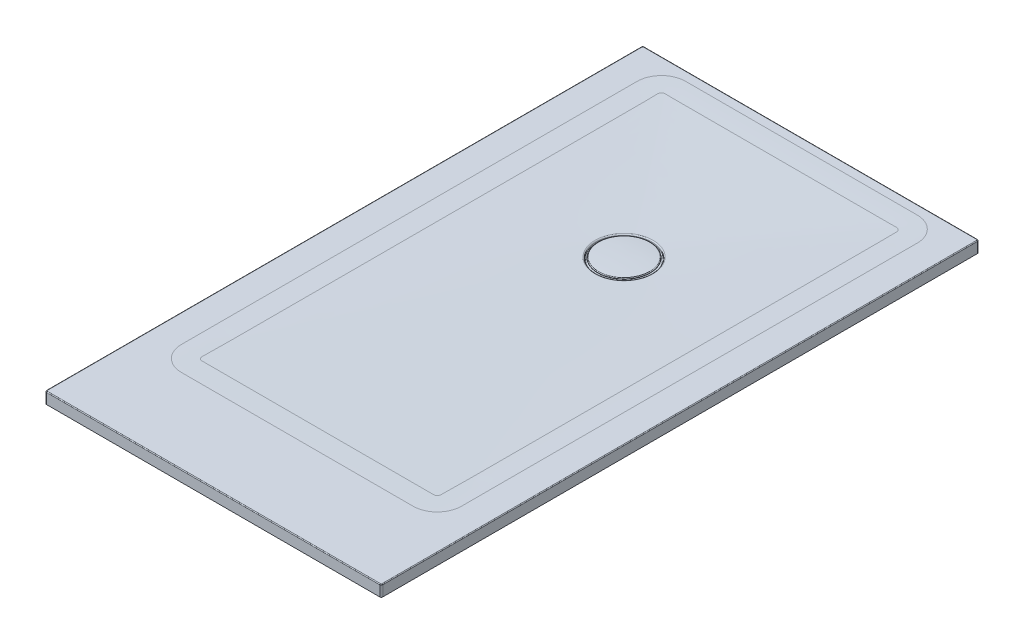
SolidWorks part; units mm, degrees
ref_plane "Płaszczyzna przednia" through (0, 0, 0) normal (0, 0, 1) x (1, 0, 0)
ref_plane "Płaszczyzna górna" through (0, 0, 0) normal (0, 1, 0) x (1, 0, 0)
ref_plane "Płaszczyzna prawa" through (0, 0, 0) normal (1, 0, 0) x (0, 0, -1)
sketch "Szkic2" plane through (0, 0, 0) normal (0, 1, 0) x (1, 0, 0)
  line L0 (0, 800) -> (0, 300) construction
  line L1 (-450, -800) -> (450, -800)
  line L2 (-450, -800) -> (-450, 800)
  line L3 (-450, 800) -> (450, 800)
  line L4 (450, -800) -> (450, 800)
  line L5 (-450, -800) -> (450, 800) construction
  line L6 (-450, 800) -> (450, -800) construction
  line L7 (-360, 760) -> (360, 760)
  line L8 (-360, 760) -> (-360, -560)
  line L9 (-360, -560) -> (360, -560)
  line L10 (360, 760) -> (360, -560)
  line L11 (-400, 800) -> (-400, -600) construction
  line L12 (-400, -600) -> (400, -600) construction
  line L13 (400, -600) -> (400, 800) construction
  circle A0 centre (0, 300) radius 75
  point P0 (0, 0)
  point P11 (0, 760)
  point P16 (0, -600)
  dimension "D9" = 150
  dimension "D1" = 900
  dimension "D2" = 1600
  dimension "D3" = 40
  dimension "D4" = 90
  dimension "D5" = 40
  dimension "D6" = 50
  dimension "D7" = 1400
  dimension "D8" = 500
sketch "Szkic3" plane through (0, 0, 0) normal (0, 1, 0) x (1, 0, 0)
  line L0 (-450, -800) -> (-450, 800) construction
  line L1 (-450, -800) -> (450, -800) construction
  line L2 (450, -800) -> (450, 800) construction
  line L3 (-450, 800) -> (450, 800) construction
  line L4 (-360, 760) -> (-360, -560) construction
  line L5 (-360, 760) -> (360, 760) construction
  line L6 (360, 760) -> (360, -560) construction
  line L7 (-360, -560) -> (360, -560) construction
  line L8 (-450, -800) -> (-450, 800)
  line L9 (-450, -800) -> (450, -800)
  line L10 (450, -800) -> (450, 800)
  line L11 (-450, 800) -> (450, 800)
  line L12 (-360, 710) -> (-360, -510)
  line L13 (-310, 760) -> (310, 760)
  line L14 (360, 710) -> (360, -510)
  line L15 (-310, -560) -> (310, -560)
  arc A0 (360, 710) -> (310, 760) centre (310, 710) ccw
  arc A1 (-310, 760) -> (-360, 710) centre (-310, 710) ccw
  arc A2 (310, -560) -> (360, -510) centre (310, -510) ccw
  arc A3 (-310, -560) -> (-360, -510) centre (-310, -510) cw
  dimension "D1" = 50
surface "Powierzchnia-Płaszczyzna1" sketch "Szkic3"
sketch "Szkic4" plane through (0, 0, 0) normal (0, 1, 0) x (1, 0, 0)
  line L0 (-360, 760) -> (-360, -560) construction
  line L1 (-360, -560) -> (360, -560) construction
  line L2 (360, 760) -> (360, -560) construction
  line L3 (-360, 760) -> (360, 760) construction
  line L4 (-360, 760) -> (-360, -560)
  line L5 (-360, -560) -> (360, -560)
  line L6 (360, 760) -> (360, -560)
  line L7 (-360, 760) -> (360, 760)
ref_plane "korek" through (0, -15, 0) normal (0, 1, 0) x (-1, 0, 0)
sketch "Szkic5" plane through (0, -15, 0) normal (0, 1, 0) x (-1, 0, 0)
  circle A0 centre (0, -300) radius 75 construction
  circle A1 centre (0, -300) radius 75
surface "Powierzchnia-Wyciągnięcie po profilach2"
surface "Powierzchnia-Połącz1"
sketch "Szkic7" plane through (0, 0, 0) normal (0, 1, 0) x (1, 0, 0)
  line L27 (310, 720) -> (-310, 720)
  line L28 (-320, 710) -> (-320, -510)
  line L29 (-310, -520) -> (310, -520)
  line L30 (320, -510) -> (320, 710)
  line L31 (310, 720) -> (-310, 720)
  line L32 (-320, 710) -> (-320, -510)
  line L33 (-310, -520) -> (310, -520)
  line L34 (320, -510) -> (320, 710)
  line L35 (310, 775) -> (-310, 775)
  line L36 (-375, 710) -> (-375, -510)
  line L37 (-310, -575) -> (310, -575)
  line L38 (375, -510) -> (375, 710)
  line L39 (310, 775) -> (-310, 775)
  line L40 (-375, 710) -> (-375, -510)
  line L41 (-310, -575) -> (310, -575)
  line L42 (375, -510) -> (375, 710)
  arc A0 (320, -510) -> (310, -520) centre (310, -510) cw
  arc A1 (-320, -510) -> (-310, -520) centre (-310, -510) ccw
  arc A2 (320, 710) -> (310, 720) centre (310, 710) ccw
  arc A3 (-320, 710) -> (-310, 720) centre (-310, 710) cw
  spline S23 degree 3 poles (-641.399, 434.849) (129.105, 603.8543) (327.0889, 675.3764) (319.7448, 712.2674) (319.666, 712.5841) (319.4757, 713.212) (319.3642, 713.5241) (318.9881, 714.4319) (318.6815, 715.0061) (318.1377, 715.8209) (317.9418, 716.0857) (317.524, 716.5952) (317.3042, 716.8377) (316.6129, 717.5296) (316.1099, 717.9435) (315.291, 718.492) (315.0071, 718.6623) (314.4303, 718.9711) (314.1358, 719.1105) (313.5347, 719.3602) (313.228, 719.4702) (312.6027, 719.6611) (312.2823, 719.7411) (241.0094, 734.0944) (80.9725, -51.7096) (205.0888, 1714.4742) knots -7.033481 -7.033481 -7.033481 -7.033481 0.125 0.125 0.1875 0.1875 0.25 0.25 0.375 0.375 0.4375 0.4375 0.5 0.5 0.625 0.625 0.6875 0.6875 0.75 0.75 0.8125 0.8125 0.875 0.875 14.60722 14.60722 14.60722 14.60722 only from (320, 710) to (310, 720)
  spline S24 degree 3 poles (-440.428, 1711.4534) (-279.1841, 688.562) (-297.6269, 720.6455) (-310.6569, 719.9802) (-310.8198, 719.9671) (-311.3068, 719.9193) (-311.629, 719.8723) (-312.2675, 719.7445) (-312.5843, 719.6661) (-313.2122, 719.4757) (-313.5243, 719.3642) (-314.432, 718.988) (-315.0062, 718.6813) (-316.0927, 717.9564) (-316.6073, 717.5346) (-317.5296, 716.6128) (-317.9435, 716.1098) (-318.492, 715.291) (-318.6623, 715.0071) (-318.9711, 714.4303) (-319.1105, 714.1358) (-319.3602, 713.5347) (-319.4702, 713.228) (-319.661, 712.6027) (-319.7414, 712.2824) (-329.2071, 664.9991) (3.328, 579.9665) (648.2833, 460.148) knots -2.425653 -2.425653 -2.425653 -2.425653 0.03125 0.03125 0.0625 0.0625 0.125 0.125 0.1875 0.1875 0.25 0.25 0.375 0.375 0.5 0.5 0.625 0.625 0.6875 0.6875 0.75 0.75 0.8125 0.8125 0.875 0.875 9.962622 9.962622 9.962622 9.962622 only from (-310, 720) to (-320, 710)
  spline S25 degree 3 poles (641.3989, -234.849) (-129.105, -403.8543) (-327.0889, -475.3764) (-319.7448, -512.2674) (-319.666, -512.5841) (-319.4757, -513.212) (-319.3642, -513.5241) (-318.9881, -514.4319) (-318.6815, -515.0061) (-318.1377, -515.8209) (-317.9418, -516.0857) (-317.524, -516.5952) (-317.3042, -516.8377) (-316.6129, -517.5296) (-316.1099, -517.9435) (-315.291, -518.492) (-315.0071, -518.6623) (-314.4303, -518.9711) (-314.1358, -519.1105) (-313.5347, -519.3602) (-313.228, -519.4702) (-312.6027, -519.6611) (-312.2823, -519.7411) (-241.0094, -534.0944) (-80.9725, 251.7096) (-205.0888, -1514.4742) knots -7.033481 -7.033481 -7.033481 -7.033481 0.125 0.125 0.1875 0.1875 0.25 0.25 0.375 0.375 0.4375 0.4375 0.5 0.5 0.625 0.625 0.6875 0.6875 0.75 0.75 0.8125 0.8125 0.875 0.875 14.60722 14.60722 14.60722 14.60722 only from (-320, -510) to (-310, -520)
  spline S26 degree 3 poles (440.428, -1511.4535) (279.1841, -488.562) (297.6269, -520.6455) (310.6569, -519.9802) (310.8198, -519.9671) (311.3068, -519.9193) (311.629, -519.8723) (312.2675, -519.7445) (312.5843, -519.6661) (313.2122, -519.4757) (313.5243, -519.3642) (314.432, -518.988) (315.0062, -518.6813) (316.0927, -517.9564) (316.6073, -517.5346) (317.5296, -516.6128) (317.9435, -516.1098) (318.492, -515.291) (318.6623, -515.0071) (318.9711, -514.4303) (319.1105, -514.1358) (319.3602, -513.5347) (319.4702, -513.228) (319.661, -512.6027) (319.7414, -512.2824) (329.2071, -464.9991) (-3.328, -379.9665) (-648.2833, -260.148) knots -2.425653 -2.425653 -2.425653 -2.425653 0.03125 0.03125 0.0625 0.0625 0.125 0.125 0.1875 0.1875 0.25 0.25 0.375 0.375 0.5 0.5 0.625 0.625 0.6875 0.6875 0.75 0.75 0.8125 0.8125 0.875 0.875 9.962622 9.962622 9.962622 9.962622 only from (310, -520) to (320, -510)
  spline S31 degree 3 poles (-2470.176, -202.3533) (-59.2357, 353.0092) (388.7143, 574.0384) (374.4776, 718.4945) (374.1669, 720.5875) (373.3421, 724.7387) (372.8284, 726.7971) (371.9014, 729.8581) (371.5659, 730.8756) (370.8441, 732.8942) (370.4597, 733.8905) (368.4228, 738.808) (366.4286, 742.5399) (363.4837, 746.9542) (362.872, 747.8245) (361.6022, 749.5393) (360.9423, 750.386) (358.9054, 752.8701) (357.4764, 754.4464) (352.9829, 758.9432) (349.7137, 761.6339) (345.2776, 764.6043) (344.3701, 765.1801) (342.5356, 766.2813) (341.6081, 766.8072) (338.796, 768.3122) (336.8815, 769.2187) (332.9741, 770.8414) (330.9812, 771.5572) (327.9325, 772.4866) (326.9062, 772.7721) (324.8335, 773.2937) (323.7851, 773.5302) (320.6362, 774.1601) (318.5251, 774.4735) (315.3412, 774.7883) (314.2772, 774.8685) (171.271, 781.9701) (-24.6038, 303.6351) (215.7481, 3751.0408) knots -4.153002 -4.153002 -4.153002 -4.153002 0.0625 0.0625 0.125 0.125 0.1875 0.1875 0.21875 0.21875 0.25 0.25 0.375 0.375 0.40625 0.40625 0.4375 0.4375 0.5 0.5 0.625 0.625 0.65625 0.65625 0.6875 0.6875 0.75 0.75 0.8125 0.8125 0.84375 0.84375 0.875 0.875 0.9375 0.9375 0.96875 0.96875 5.125575 5.125575 5.125575 5.125575 only from (375, 710) to (310, 775)
  spline S32 degree 3 poles (-366.4795, 3748.8604) (78.4358, 250.2272) (-163.3454, 782.3527) (-314.2695, 774.8689) (-315.3288, 774.7893) (-318.4945, 774.4772) (-320.5876, 774.1673) (-324.7388, 773.3418) (-326.7972, 772.8285) (-329.8582, 771.9015) (-330.8757, 771.5658) (-332.8943, 770.8441) (-333.8906, 770.4597) (-338.8081, 768.4227) (-342.54, 766.4285) (-346.9543, 763.4837) (-347.8245, 762.8719) (-349.5393, 761.6021) (-350.386, 760.9423) (-352.8701, 758.9054) (-354.4464, 757.4764) (-358.9432, 752.9828) (-361.6338, 749.7137) (-364.6043, 745.2777) (-365.18, 744.3702) (-366.2812, 742.5356) (-366.8071, 741.6082) (-368.3122, 738.7961) (-369.2187, 736.8815) (-370.8413, 732.9742) (-371.5572, 730.9813) (-372.4865, 727.9325) (-372.772, 726.9063) (-373.2938, 724.8337) (-373.5303, 723.7852) (-412.7967, 527.3214) (454.4469, 231.2431) (2469.5439, -192.3292) knots -4.370349 -4.370349 -4.370349 -4.370349 0.03125 0.03125 0.0625 0.0625 0.125 0.125 0.1875 0.1875 0.21875 0.21875 0.25 0.25 0.375 0.375 0.40625 0.40625 0.4375 0.4375 0.5 0.5 0.625 0.625 0.65625 0.65625 0.6875 0.6875 0.75 0.75 0.8125 0.8125 0.84375 0.84375 0.875 0.875 6.692797 6.692797 6.692797 6.692797 only from (-310, 775) to (-375, 710)
  spline S33 degree 3 poles (2470.1761, 402.3534) (59.2357, -153.0092) (-388.7143, -374.0384) (-374.4776, -518.4945) (-374.1669, -520.5875) (-373.3421, -524.7387) (-372.8284, -526.7971) (-371.9014, -529.8581) (-371.5659, -530.8756) (-370.8441, -532.8942) (-370.4597, -533.8905) (-368.4228, -538.808) (-366.4286, -542.5399) (-363.4837, -546.9542) (-362.872, -547.8245) (-361.6022, -549.5393) (-360.9423, -550.386) (-358.9054, -552.8701) (-357.4764, -554.4464) (-352.9829, -558.9432) (-349.7137, -561.6339) (-345.2776, -564.6043) (-344.3701, -565.1801) (-342.5356, -566.2813) (-341.6081, -566.8072) (-338.796, -568.3122) (-336.8815, -569.2187) (-332.9741, -570.8414) (-330.9812, -571.5572) (-327.9325, -572.4866) (-326.9062, -572.7721) (-324.8335, -573.2937) (-323.7851, -573.5302) (-320.6362, -574.1601) (-318.5251, -574.4735) (-315.3412, -574.7883) (-314.2772, -574.8685) (-171.271, -581.9701) (24.6038, -103.6351) (-215.7481, -3551.0408) knots -4.153002 -4.153002 -4.153002 -4.153002 0.0625 0.0625 0.125 0.125 0.1875 0.1875 0.21875 0.21875 0.25 0.25 0.375 0.375 0.40625 0.40625 0.4375 0.4375 0.5 0.5 0.625 0.625 0.65625 0.65625 0.6875 0.6875 0.75 0.75 0.8125 0.8125 0.84375 0.84375 0.875 0.875 0.9375 0.9375 0.96875 0.96875 5.125575 5.125575 5.125575 5.125575 only from (-375, -510) to (-310, -575)
  spline S34 degree 3 poles (366.4794, -3548.8599) (-78.4358, -50.2272) (163.3454, -582.3527) (314.2695, -574.8689) (315.3288, -574.7893) (318.4945, -574.4772) (320.5876, -574.1673) (324.7388, -573.3418) (326.7972, -572.8285) (329.8582, -571.9015) (330.8757, -571.5658) (332.8943, -570.8441) (333.8906, -570.4597) (338.8081, -568.4227) (342.54, -566.4285) (346.9543, -563.4837) (347.8245, -562.8719) (349.5393, -561.6021) (350.386, -560.9423) (352.8701, -558.9054) (354.4464, -557.4764) (358.9432, -552.9828) (361.6338, -549.7137) (364.6043, -545.2777) (365.18, -544.3702) (366.2812, -542.5356) (366.8071, -541.6082) (368.3122, -538.7961) (369.2187, -536.8815) (370.8413, -532.9742) (371.5572, -530.9813) (372.4865, -527.9325) (372.772, -526.9063) (373.2938, -524.8337) (373.5303, -523.7852) (412.7967, -327.3214) (-454.4469, -31.2431) (-2469.5439, 392.3292) knots -4.370349 -4.370349 -4.370349 -4.370349 0.03125 0.03125 0.0625 0.0625 0.125 0.125 0.1875 0.1875 0.21875 0.21875 0.25 0.25 0.375 0.375 0.40625 0.40625 0.4375 0.4375 0.5 0.5 0.625 0.625 0.65625 0.65625 0.6875 0.6875 0.75 0.75 0.8125 0.8125 0.84375 0.84375 0.875 0.875 6.692797 6.692797 6.692797 6.692797 only from (310, -575) to (375, -510)
  spline S35 degree 3 poles (375, 710) (375, 712.1459) (374.8936, 714.2736) (374.4776, 718.4945) (374.1669, 720.5875) (373.3421, 724.7387) (372.8284, 726.7971) (371.9014, 729.8581) (371.5659, 730.8756) (370.8441, 732.8942) (370.4597, 733.8905) (368.4228, 738.808) (366.4286, 742.5399) (363.4837, 746.9542) (362.872, 747.8245) (361.6022, 749.5393) (360.9423, 750.386) (358.9054, 752.8701) (357.4764, 754.4464) (352.9829, 758.9432) (349.7137, 761.6339) (345.2776, 764.6043) (344.3701, 765.1801) (342.5356, 766.2813) (341.6081, 766.8072) (338.796, 768.3122) (336.8815, 769.2187) (332.9741, 770.8414) (330.9812, 771.5572) (327.9325, 772.4866) (326.9062, 772.7721) (324.8335, 773.2937) (323.7851, 773.5302) (320.6362, 774.1601) (318.5251, 774.4735) (315.3412, 774.7883) (314.2772, 774.8685) (312.1431, 774.9744) (311.073, 775) (310, 775) knots 0 0 0 0 0.0625 0.0625 0.125 0.125 0.1875 0.1875 0.21875 0.21875 0.25 0.25 0.375 0.375 0.40625 0.40625 0.4375 0.4375 0.5 0.5 0.625 0.625 0.65625 0.65625 0.6875 0.6875 0.75 0.75 0.8125 0.8125 0.84375 0.84375 0.875 0.875 0.9375 0.9375 0.96875 0.96875 1 1 1 1
  spline S36 degree 3 poles (-310, 775) (-311.0729, 775) (-312.1415, 774.9744) (-314.2695, 774.8689) (-315.3288, 774.7893) (-318.4945, 774.4772) (-320.5876, 774.1673) (-324.7388, 773.3418) (-326.7972, 772.8285) (-329.8582, 771.9015) (-330.8757, 771.5658) (-332.8943, 770.8441) (-333.8906, 770.4597) (-338.8081, 768.4227) (-342.54, 766.4285) (-346.9543, 763.4837) (-347.8245, 762.8719) (-349.5393, 761.6021) (-350.386, 760.9423) (-352.8701, 758.9054) (-354.4464, 757.4764) (-358.9432, 752.9828) (-361.6338, 749.7137) (-364.6043, 745.2777) (-365.18, 744.3702) (-366.2812, 742.5356) (-366.8071, 741.6082) (-368.3122, 738.7961) (-369.2187, 736.8815) (-370.8413, 732.9742) (-371.5572, 730.9813) (-372.4865, 727.9325) (-372.772, 726.9063) (-373.2938, 724.8337) (-373.5303, 723.7852) (-374.5792, 718.5369) (-375, 714.2918) (-375, 710) knots 0 0 0 0 0.03125 0.03125 0.0625 0.0625 0.125 0.125 0.1875 0.1875 0.21875 0.21875 0.25 0.25 0.375 0.375 0.40625 0.40625 0.4375 0.4375 0.5 0.5 0.625 0.625 0.65625 0.65625 0.6875 0.6875 0.75 0.75 0.8125 0.8125 0.84375 0.84375 0.875 0.875 1 1 1 1
  spline S37 degree 3 poles (-375, -510) (-375, -512.1459) (-374.8936, -514.2736) (-374.4776, -518.4945) (-374.1669, -520.5875) (-373.3421, -524.7387) (-372.8284, -526.7971) (-371.9014, -529.8581) (-371.5659, -530.8756) (-370.8441, -532.8942) (-370.4597, -533.8905) (-368.4228, -538.808) (-366.4286, -542.5399) (-363.4837, -546.9542) (-362.872, -547.8245) (-361.6022, -549.5393) (-360.9423, -550.386) (-358.9054, -552.8701) (-357.4764, -554.4464) (-352.9829, -558.9432) (-349.7137, -561.6339) (-345.2776, -564.6043) (-344.3701, -565.1801) (-342.5356, -566.2813) (-341.6081, -566.8072) (-338.796, -568.3122) (-336.8815, -569.2187) (-332.9741, -570.8414) (-330.9812, -571.5572) (-327.9325, -572.4866) (-326.9062, -572.7721) (-324.8335, -573.2937) (-323.7851, -573.5302) (-320.6362, -574.1601) (-318.5251, -574.4735) (-315.3412, -574.7883) (-314.2772, -574.8685) (-312.1431, -574.9744) (-311.073, -575) (-310, -575) knots 0 0 0 0 0.0625 0.0625 0.125 0.125 0.1875 0.1875 0.21875 0.21875 0.25 0.25 0.375 0.375 0.40625 0.40625 0.4375 0.4375 0.5 0.5 0.625 0.625 0.65625 0.65625 0.6875 0.6875 0.75 0.75 0.8125 0.8125 0.84375 0.84375 0.875 0.875 0.9375 0.9375 0.96875 0.96875 1 1 1 1
  spline S38 degree 3 poles (310, -575) (311.0729, -575) (312.1415, -574.9744) (314.2695, -574.8689) (315.3288, -574.7893) (318.4945, -574.4772) (320.5876, -574.1673) (324.7388, -573.3418) (326.7972, -572.8285) (329.8582, -571.9015) (330.8757, -571.5658) (332.8943, -570.8441) (333.8906, -570.4597) (338.8081, -568.4227) (342.54, -566.4285) (346.9543, -563.4837) (347.8245, -562.8719) (349.5393, -561.6021) (350.386, -560.9423) (352.8701, -558.9054) (354.4464, -557.4764) (358.9432, -552.9828) (361.6338, -549.7137) (364.6043, -545.2777) (365.18, -544.3702) (366.2812, -542.5356) (366.8071, -541.6082) (368.3122, -538.7961) (369.2187, -536.8815) (370.8413, -532.9742) (371.5572, -530.9813) (372.4865, -527.9325) (372.772, -526.9063) (373.2938, -524.8337) (373.5303, -523.7852) (374.5792, -518.5369) (375, -514.2918) (375, -510) knots 0 0 0 0 0.03125 0.03125 0.0625 0.0625 0.125 0.125 0.1875 0.1875 0.21875 0.21875 0.25 0.25 0.375 0.375 0.40625 0.40625 0.4375 0.4375 0.5 0.5 0.625 0.625 0.65625 0.65625 0.6875 0.6875 0.75 0.75 0.8125 0.8125 0.84375 0.84375 0.875 0.875 1 1 1 1
  dimension "D3" = 10
  dimension "D1" = 40
  dimension "D2" = 15
other "Usuń ścianę1"
other "Granica-Powierzchnia1"
surface "Powierzchnia-Połącz2"
sketch "Szkic9" plane through (0, 0, 0) normal (0, 1, 0) x (1, 0, 0)
  line L0 (-450, -800) -> (450, -800) construction
  line L1 (-450, -800) -> (-450, 800) construction
  line L2 (450, -800) -> (450, 800) construction
  line L3 (-450, 800) -> (450, 800) construction
  line L4 (-450, -800) -> (450, -800)
  line L5 (-450, -800) -> (-450, 800)
  line L6 (450, -800) -> (450, 800)
  line L7 (-450, 800) -> (450, 800)
surface "Powierzchnia-Wyciągnięcie1" sketch "Szkic9" parameters "D1"=30
sketch "Szkic8" plane through (0, 0, 0) normal (1, 0, 0) x (0, 0, -1)
  line L0 (300, 0) -> (300, -30) construction
  line L1 (225, -15) -> (225.2968, -23.5)
  line L4 (225.2968, -23.5) -> (248, -24.0945)
  line L5 (225.2968, -23.5) -> (300, -23.5) construction
  line L6 (248, -24.0945) -> (248, -30) construction
  line L7 (300, -30) -> (225.2968, -30) construction
  line L8 (225.2968, -30) -> (225.2968, -23.5) construction
  line L9 (255, -28) -> (255, -30)
  line L10 (248, -24.0945) -> (255, -28)
  dimension "D1" = 30
  dimension "D2" = 8.5
  dimension "D3" = 2
  dimension "D4" = 1.5
  dimension "D5" = 52
  dimension "D6" = 45
  dimension "D7" = 2
surface "Powierzchnia-Obrót1" sketch "Szkic8" parameters "D1"=360
surface "Powierzchnia-Płaszczyzna2"
surface "Powierzchnia-Połącz3"
fillet "Zaokrąglenie4" radius 4 4 edges at (-450, -15, -800) (450, -15, -800) (-450, -15, 800) (450, -15, 800)
fillet "Zaokrąglenie5" radius 3 3 edges at (0, -24.0945, -352) (0, -23.5, -374.7032)
fillet "Zaokrąglenie6" radius 2 9 edges at (448.8284, 0, 798.8284) (0, 0, 800) (-448.8284, 0, 798.8284) (-450, 0, 0) (-448.8284, 0, -798.8284) (0, 0, -800) (448.8284, 0, -798.8284) (450, 0, 0) (0, -28, -345)
sketch "Szkic11" plane through (0, 0, 0) normal (1, 0, 0) x (0, 0, -1)
  line L0 (300, 0) -> (300, -30) construction
  line L1 (-796, -30) -> (796, -30) construction
  line L2 (300, -17) -> (300, -11.5)
  line L14 (370, -11.5) -> (370, -14.5) construction
  line L16 (370, -17) -> (300, -17)
  line L18 (370, -17) -> (370, -16.3377)
  line L19 (300, -11.5) -> (370, -11.5) construction
  arc A0 (370, -16.3377) -> (368.1666, -14.3446) centre (368, -16.3377) ccw
  arc A6 (368.1666, -14.3446) -> (300, -11.5) centre (300, -829.6667) ccw
  dimension "D2" = 2
  dimension "D8" = 2.5
  dimension "D9" = 17
  dimension "D10" = 5.5
  dimension "D11" = 70
revolve "Obrót1" add sketch "Szkic11" angle 360 about L0
